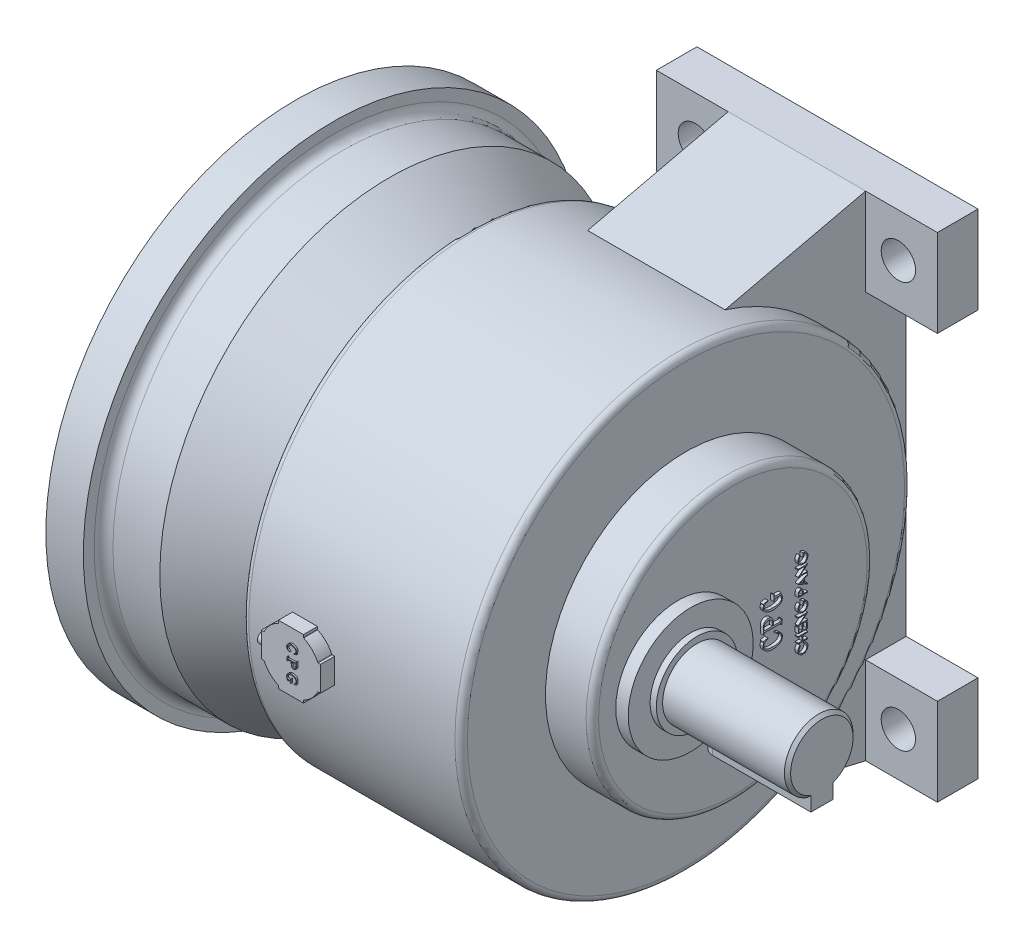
SolidWorks part; units mm, degrees
ref_plane "前视基准面" through (0, 0, 0) normal (0, 0, 1) x (1, 0, 0)
ref_plane "上视基准面" through (0, 0, 0) normal (0, 1, 0) x (1, 0, 0)
ref_plane "右视基准面" through (0, 0, 0) normal (1, 0, 0) x (0, 0, -1)
ref_plane "基准面1" through (0, 0, -97.5) normal (0, 0, 1) x (1, 0, 0)
sketch "草图1" plane through (0, 0, 0) normal (0, 1, 0) x (1, 0, 0)
  line L0 (0, 0) -> (33.1729, 0) construction
  line L1 (0, 0) -> (0, -11)
  line L2 (0, -11) -> (-40, -11)
  line L3 (-40, -11) -> (-40, -13)
  line L4 (-40, -13) -> (-42, -13)
  line L5 (-42, -13) -> (-42, -20)
  line L6 (-42, -20) -> (-46, -20)
  line L7 (-46, -20) -> (-46, 0)
  line L8 (-46, 0) -> (0, 0)
  dimension "D1" = 40
  dimension "D2" = 22
  dimension "D3" = 26
  dimension "D4" = 2
  dimension "D5" = 40
  dimension "D6" = 4
revolve "旋转1" add sketch "草图1" angle 360 about L0
sketch "草图2" plane through (0, 0, 0) normal (0, 1, 0) x (1, 0, 0)
  line L0 (8.0167, 17.5) -> (-46, 17.5) construction
  line L1 (-46, 17.5) -> (-46, -27.5)
  line L2 (-46, 20) -> (-46, -20) construction
  line L3 (-46, -27.5) -> (-61, -27.5)
  line L4 (-61, -27.5) -> (-61, -54.5)
  line L5 (-61, -54.5) -> (-131, -54.5)
  line L6 (-131, -54.5) -> (-131, 17.5)
  line L11 (-46, 17.5) -> (-131, 17.5)
  line L13 (-103.125, 97.5) -> (103.125, 97.5) construction
  dimension "D1" = 17.5
  dimension "D2" = 90
  dimension "D3" = 15
  dimension "D4" = 152
  dimension "D5" = 70
revolve "旋转2" add sketch "草图2" angle 360 about L0
sketch "草图3" plane through (0, 0, -97.5) normal (0, 0, 1) x (1, 0, 0)
  line L0 (0, 0) -> (40.0459, 0) construction
  line L1 (-137.5, -51) -> (-47.5, -51)
  line L2 (-137.5, -51) -> (-137.5, -79)
  line L3 (-137.5, -79) -> (-47.5, -79)
  line L4 (-47.5, -51) -> (-47.5, -79)
  line L5 (0, -11) -> (0, 11) construction
  circle A0 centre (-60, -65) radius 5.5
  circle A1 centre (-125, -65) radius 5.5
  dimension "D2" = 130
  dimension "D3" = 11
  dimension "D4" = 65
  dimension "D6" = 60
  dimension "D8" = 28
  dimension "D1" = 158
  dimension "D5" = 90
  dimension "D7" = 12.5
extrude "拉伸2" add sketch "草图3" along normal blind 13
mirror "镜向2" about plane through (0, 0, 0) normal (0, 1, 0)
ref_plane "基准面4" through (-92.5, 0, 0) normal (1, 0, 0) x (0, 0, -1)
sketch "草图4" plane through (-92.5, 0, 0) normal (1, 0, 0) x (0, 0, -1)
  line L0 (84.5, 51) -> (97.5, 51) construction
  line L1 (84.5, 51) -> (97.5, 51)
  line L2 (84.5, 79) -> (84.5, 51) construction
  line L3 (84.5, 79) -> (84.5, 51)
  line L4 (84.5, -51) -> (97.5, -51) construction
  line L5 (84.5, -51) -> (97.5, -51)
  line L6 (84.5, -79) -> (84.5, -51) construction
  line L7 (84.5, -79) -> (84.5, -51)
  line L8 (97.5, 51) -> (97.5, -51)
  line L9 (84.5, 79) -> (39.5, 68.5565)
  line L11 (39.5, -68.5565) -> (84.5, -79)
  arc A1 (39.5, -68.5565) -> (39.5, 68.5565) centre (17.5, 0) ccw
  circle A2 centre (17.5, 0) radius 72 construction
  dimension "D1" = 45
extrude "拉伸3" add sketch "草图4" against normal mid plane 44
sketch "草图5" plane through (0, 0, 0) normal (0, 1, 0) x (1, 0, 0)
  line L0 (0, -3.5) -> (-31.5, -3.5)
  line L1 (0, -11) -> (0, 11) construction
  line L2 (-31.5, 3.5) -> (0, 3.5)
  line L3 (0, 3.5) -> (0, -3.5)
  line L4 (25, -13.7955) -> (25, 19.6443) construction
  arc A0 (-31.5, -3.5) -> (-31.5, 3.5) centre (-31.5, 0) cw
  dimension "D2" = 35
  dimension "D1" = 7
  dimension "D3" = 25
extrude "拉伸4" add sketch "草图5" against normal blind 14
fillet "圆角1" radius 2 3 edges at (-131, 0, -89.5) (-61, 0, -89.5) (-46, 0, -62.5)
chamfer "倒角1" distance 1 angle 45 1 edges at (0, 11, 0)
sketch "草圖3" plane through (0, 0, 0) normal (0, 1, 0) x (1, 0, 0)
  line L1 (-181.9137, 67.488) -> (-182, 67.5871)
  line L9 (-186, 97.5) -> (-186, 73.5)
  line L10 (-185, 72.5) -> (-182, 72.5)
  line L11 (-182, 72.5) -> (-182, 67.5871)
  line L12 (-181.9137, 67.488) -> (-161, 64.5869)
  line L13 (-161, 57.0606) -> (-161, 51.5)
  line L14 (-164, 48.5) -> (-179, 48.5)
  line L15 (-180, 38.5) -> (-178.8, 38.5)
  line L16 (-180, 47.5) -> (-180, 38.5)
  line L17 (-178.5, 38.2) -> (-178.5, 17.5)
  line L26 (-15.3592, 17.5) -> (-187.5963, 17.5) construction
  line L27 (-131, 17.5) -> (-178.5, 17.5)
  line L28 (-131, 78.5) -> (-131, 17.5)
  line L29 (-131, 78.5) -> (-136, 78.5)
  line L30 (-136, 78.5) -> (-156, 91)
  line L31 (-156, 91) -> (-171, 91)
  line L32 (-174, 94) -> (-174, 97.5)
  line L33 (-174, 97.5) -> (-186, 97.5)
  line L34 (19.9234, 0) -> (-221.4481, 0) construction
  arc A6 (-186, 73.5) -> (-185, 72.5) centre (-185, 73.5) ccw
  arc A7 (-159.7461, 59.5001) -> (-161, 64.5869) centre (-161.3875, 61.7934) ccw
  arc A8 (-159.7461, 59.5001) -> (-161, 57.0606) centre (-158, 57.0606) ccw
  arc A9 (-164, 48.5) -> (-161, 51.5) centre (-164, 51.5) ccw
  arc A10 (-179, 48.5) -> (-180, 47.5) centre (-179, 47.5) ccw
  arc A11 (-178.5, 38.2) -> (-178.8, 38.5) centre (-178.8, 38.2) ccw
  arc A13 (-174, 94) -> (-171, 91) centre (-171, 94) ccw
  dimension "D1" = 17.5
  dimension "D2" = 160
  dimension "D3" = 110
  dimension "D4" = 55
revolve "旋轉1" add sketch "草圖3" angle 360 about L26
sketch "草圖5" plane through (-186, 0, 0) normal (-1, 0, 0) x (0, 0, 1)
  line L0 (67.7669, 0) -> (-124.3021, 0) construction
  line L2 (-17.5, 97.857) -> (-17.5, -89.8335) construction
  circle A0 centre (-17.5, 0) radius 65 construction
  circle A1 centre (28.4619, 45.9619) radius 4
  circle A2 centre (28.4619, -45.9619) radius 4
  circle A3 centre (-63.4619, -45.9619) radius 4
  circle A4 centre (-63.4619, 45.9619) radius 4
  dimension "D1" = 130
  dimension "D2" = 8
extrude "伸長1" cut sketch "草圖5" against normal blind 25
sketch "草圖7" plane through (-186, 0, 0) normal (-1, 0, 0) x (0, 0, 1)
  line L0 (-17.4992, 0) -> (-83.7629, 0) construction
  line L1 (-78.6326, 25.778) -> (-58.9287, 5.5251)
  line L2 (-78.6326, -25.2495) -> (-58.8647, -5.4747)
  line L3 (-57.9233, 10.7256) -> (-64.9943, 17.7967)
  line L4 (-35.2959, 47.4952) -> (-28.2248, 40.4241)
  line L5 (-64.2557, 35.0893) -> (-52.5885, 46.7566)
  line L6 (-43.2772, 61.1334) -> (-23.5024, 41.3656)
  line L7 (7.7503, 61.1334) -> (-12.5026, 41.4295)
  line L8 (17.0615, 46.7566) -> (28.7288, 35.0893)
  line L9 (-7.3021, 40.4241) -> (-0.2311, 47.4952)
  line L10 (29.4674, 17.7967) -> (22.3964, 10.7256)
  line L11 (43.1056, 25.778) -> (23.3378, 6.0033)
  line L12 (43.1056, -25.2495) -> (23.4017, -4.9966)
  line L13 (28.7288, -34.5607) -> (17.0615, -46.228)
  line L14 (22.3964, -10.197) -> (29.4674, -17.2681)
  line L15 (-0.2311, -46.9666) -> (-7.3021, -39.8955)
  line L16 (7.7503, -60.6048) -> (-12.0245, -40.837)
  line L17 (-43.2772, -60.6048) -> (-23.0243, -40.9009)
  line L18 (-52.5885, -46.228) -> (-64.2557, -34.5607)
  line L19 (-28.2248, -39.8955) -> (-35.2959, -46.9666)
  line L20 (-64.9943, -17.2681) -> (-57.9233, -10.197)
  line L21 (17.0615, 46.7566) -> (28.7288, 35.0893)
  line L22 (-7.3021, 40.4241) -> (-0.2311, 47.4952)
  line L23 (29.4674, 17.7967) -> (22.3964, 10.7256)
  line L24 (22.3964, -10.197) -> (29.4674, -17.2681)
  line L25 (-0.2311, -46.9666) -> (-7.3021, -39.8955)
  line L26 (28.7288, -34.5607) -> (17.0615, -46.228)
  line L27 (-52.5885, -46.228) -> (-64.2557, -34.5607)
  line L28 (-64.9943, -17.2681) -> (-57.9233, -10.197)
  line L29 (-28.2248, -39.8955) -> (-35.2959, -46.9666)
  arc A0 (-78.6326, 25.778) -> (-78.6326, -25.2495) centre (-17.7635, 0.2643) ccw
  arc A1 (-28.2248, 40.4241) -> (-57.9233, 10.7256) centre (-17.7635, 0.2643) ccw
  arc A2 (22.3964, 10.7256) -> (-7.3021, 40.4241) centre (-17.7635, 0.2643) ccw
  arc A3 (-58.9287, 5.5251) -> (-58.8647, -5.4747) centre (-17.7635, 0.2643) ccw
  arc A4 (7.7503, 61.1334) -> (-43.2772, 61.1334) centre (-17.7635, 0.2643) ccw
  arc A5 (-12.5026, 41.4295) -> (-23.5024, 41.3656) centre (-17.7635, 0.2643) ccw
  arc A6 (-7.3021, -39.8955) -> (22.3964, -10.197) centre (-17.7635, 0.2643) ccw
  arc A7 (43.1056, -25.2495) -> (43.1056, 25.778) centre (-17.7635, 0.2643) ccw
  arc A8 (23.4017, -4.9966) -> (23.3378, 6.0033) centre (-17.7635, 0.2643) ccw
  arc A9 (-57.9233, -10.197) -> (-28.2248, -39.8955) centre (-17.7635, 0.2643) ccw
  arc A10 (-43.2772, -60.6048) -> (7.7503, -60.6048) centre (-17.7635, 0.2643) ccw
  arc A11 (-23.0243, -40.9009) -> (-12.0245, -40.837) centre (-17.7635, 0.2643) ccw
  arc A12 (22.3964, 10.7256) -> (-7.3021, 40.4241) centre (-17.7635, 0.2643) ccw
  arc A13 (-7.3021, -39.8955) -> (22.3964, -10.197) centre (-17.7635, 0.2643) ccw
  arc A14 (-57.9233, -10.197) -> (-28.2248, -39.8955) centre (-17.7635, 0.2643) ccw
  spline S0 degree 2 poles (-64.9943, 17.7967) (-69.8347, 26.6584) (-64.2557, 35.0893) knots 0 0 0 1 1 1
  spline S1 degree 2 poles (-35.2959, 47.4952) (-44.1575, 52.3355) (-52.5885, 46.7566) knots 0 0 0 1 1 1
  spline S2 degree 2 poles (29.4674, 17.7967) (34.3078, 26.6584) (28.7288, 35.0893) knots 0 0 0 1 1 1
  spline S3 degree 2 poles (-0.2311, 47.4952) (8.6306, 52.3355) (17.0615, 46.7566) knots 0 0 0 1 1 1
  spline S4 degree 2 poles (-0.2311, -46.9666) (8.6306, -51.807) (17.0615, -46.228) knots 0 0 0 1 1 1
  spline S5 degree 2 poles (29.4674, -17.2681) (34.3078, -26.1298) (28.7288, -34.5607) knots 0 0 0 1 1 1
  spline S6 degree 2 poles (-64.9943, -17.2681) (-69.8347, -26.1298) (-64.2557, -34.5607) knots 0 0 0 1 1 1
  spline S7 degree 2 poles (-35.2959, -46.9666) (-44.1575, -51.807) (-52.5885, -46.228) knots 0 0 0 1 1 1
extrude "伸長2" cut sketch "草圖7" against normal blind 39 draft 1 contours L0 L1 A0 M5 | L0 A0 L2 M5 | L0 A3 L1 M5 | A3 L0 L2 M5 | L4 S1 S0 L3 A1 M5 | S1 L5 S0 M5 | L7 A4 L6 M5 | A5 L7 L6 M5 | S3 S2 L8 M5 | L12 A7 L11 M5 | A8 L12 L11 M5 | S5 L14 A6 L15 S4 M5 | S5 S4 L13 M5 | L17 A10 L16 M5 | A11 L17 L16 M5 | S7 L19 A9 L20 S6 M5 | S3 L9 A2 L10 S2 M5
sketch "草圖8" plane through (-147, 0, 0) normal (-1, 0, 0) x (0, 0, 1)
  line L0 (-78.5, 0) -> (-17.5, 0) construction
  circle A0 centre (-17.5, 0) radius 51.5 construction
  circle A1 centre (-53.916, 36.416) radius 3
  circle A2 centre (18.916, 36.416) radius 3
  circle A3 centre (18.916, -36.416) radius 3
  circle A4 centre (-53.916, -36.416) radius 3
  dimension "D1" = 103
  dimension "D2" = 6
extrude "伸長3" cut sketch "草圖8" against normal blind 11
sketch "草圖9" plane through (-178.5, 0, 0) normal (-1, 0, 0) x (0, 0, 1)
  line L0 (-17.5034, -16.5253) -> (-17.5034, 16) construction
  line L1 (-8.2034, -2.5) -> (-8.2034, 2.5)
  line L2 (-8.2034, -2.5) -> (-10.9651, -2.5)
  line L3 (-35.2448, 0) -> (-0.9193, 0) construction
  line L4 (-8.2034, 2.5) -> (-10.9651, 2.5)
  circle A0 centre (-17.5034, 0) radius 12.5 construction
  arc A2 (-10.9651, 2.5) -> (-10.9651, -2.5) centre (-17.5034, 0) ccw
  dimension "D1" = 25
  dimension "D2" = 5
  dimension "D5" = 14
  dimension "D4" = 9.3
extrude "伸長4" cut sketch "草圖9" against normal blind 28
sketch "草圖10" plane through (-178.5, 0, 0) normal (-1, 0, 0) x (0, 0, 1)
  line L0 (-10.9651, -2.5) -> (-8.2034, -2.5) construction
  line L1 (-8.2034, -2.5) -> (-8.2034, 2.5) construction
  line L2 (-8.2034, 2.5) -> (-10.9651, 2.5) construction
  line L3 (-10.9651, -2.5) -> (-8.2034, -2.5)
  line L4 (-8.2034, -2.5) -> (-8.2034, 2.5)
  line L5 (-8.2034, 2.5) -> (-10.9651, 2.5)
  circle A0 centre (-17.5, 0) radius 12.5
  arc A1 (-10.9651, 2.5) -> (-10.9651, -2.5) centre (-17.5034, 0) ccw construction
  arc A2 (-10.9651, 2.5) -> (-10.9651, -2.5) centre (-17.5034, 0) ccw
  dimension "D1" = 25
extrude "伸長7" add sketch "草圖10" along normal blind 1
sketch "草圖11"
extrude "伸長8" add sketch "草圖11" along normal blind 1
ref_plane "平面1" through (0, 0, 59) normal (0, 0, 1) x (1, 0, 0)
sketch "草圖12" plane through (0, 0, 59) normal (0, 0, 1) x (1, 0, 0)
  line L0 (-115, 9.5) -> (-107, 9.5)
  line L2 (-115, 8.7121) -> (-115, 9.5)
  line L3 (-107, 8.7121) -> (-107, 9.5)
  line L4 (-119.7121, 4) -> (-120.5, 4)
  line L5 (-119.7121, -4) -> (-120.5, -4)
  line L6 (-120.5, -4) -> (-120.5, 4)
  line L7 (-115, -8.7121) -> (-115, -9.5)
  line L8 (-107, -8.7121) -> (-107, -9.5)
  line L9 (-107, -9.5) -> (-115, -9.5)
  line L10 (-102.2879, -4) -> (-101.5, -4)
  line L11 (-102.2879, 4) -> (-101.5, 4)
  line L12 (-101.5, 4) -> (-101.5, -4)
  arc A0 (-115.0855, 8.5766) -> (-119.5766, 4.0855) centre (-111, 0) ccw
  arc A1 (-115.0855, 8.5766) -> (-115, 8.7121) centre (-115.15, 8.7121) ccw
  arc A2 (-107, 8.7121) -> (-106.9145, 8.5766) centre (-106.85, 8.7121) ccw
  arc A3 (-119.7121, 4) -> (-119.5766, 4.0855) centre (-119.7121, 4.15) ccw
  arc A4 (-119.5766, -4.0855) -> (-119.7121, -4) centre (-119.7121, -4.15) ccw
  arc A5 (-115, -8.7121) -> (-115.0855, -8.5766) centre (-115.15, -8.7121) ccw
  arc A6 (-106.9145, -8.5766) -> (-107, -8.7121) centre (-106.85, -8.7121) ccw
  arc A7 (-102.2879, -4) -> (-102.4234, -4.0855) centre (-102.2879, -4.15) ccw
  arc A8 (-102.4234, 4.0855) -> (-102.2879, 4) centre (-102.2879, 4.15) ccw
  arc A9 (-119.5766, -4.0855) -> (-115.0855, -8.5766) centre (-111, 0) ccw
  arc A10 (-106.9145, -8.5766) -> (-102.4234, -4.0855) centre (-111, 0) ccw
  arc A11 (-102.4234, 4.0855) -> (-106.9145, 8.5766) centre (-111, 0) ccw
extrude "伸長9" add sketch "草圖12" against normal blind 4.5 separate body
sketch "草圖13"
extrude "伸長10" add sketch "草圖13" along normal blind 0.5
sketch "草圖14" plane through (0, 0, 0) normal (0, 1, 0) x (1, 0, 0)
  line L0 (-119.4836, -55.7307) -> (-115.814, -55.9345)
  line L1 (-121.1145, -55.7307) -> (-119.4836, -55.7307)
  line L2 (-121.1145, -55.7307) -> (-121.1145, -55.1191)
  line L3 (-122.3376, -55.1191) -> (-121.1145, -55.1191)
  line L4 (-115.814, -56.75) -> (-115.814, -55.9345)
  line L5 (-115.814, -56.75) -> (-122.3376, -56.75)
  line L6 (-122.3376, -55.1191) -> (-122.3376, -56.75)
revolve "旋轉2" add sketch "草圖14" angle 360 about L5
equation "\"D7@草图3\"=(\"D5@草图3\"-\"D4@草图3\")/2"
equation "\"D8@草图3\" = \"D1@草图3\"-\"D2@草图3\""
equation "\"D3@草图1\"=\"D2@草图1\"+4"
equation "\"D5@草图2\" = \"D5@草图3\"-20"
equation "\"D1@拉伸4\" = \"D3@草图5\"-\"D2@草图1\"/2"
equation "\"D1@基准面4\" = \"D5@草图3\"/2"
equation "\"D1@拉伸3\" = \"D4@草图3\"-\"D3@草图3\"-10"
